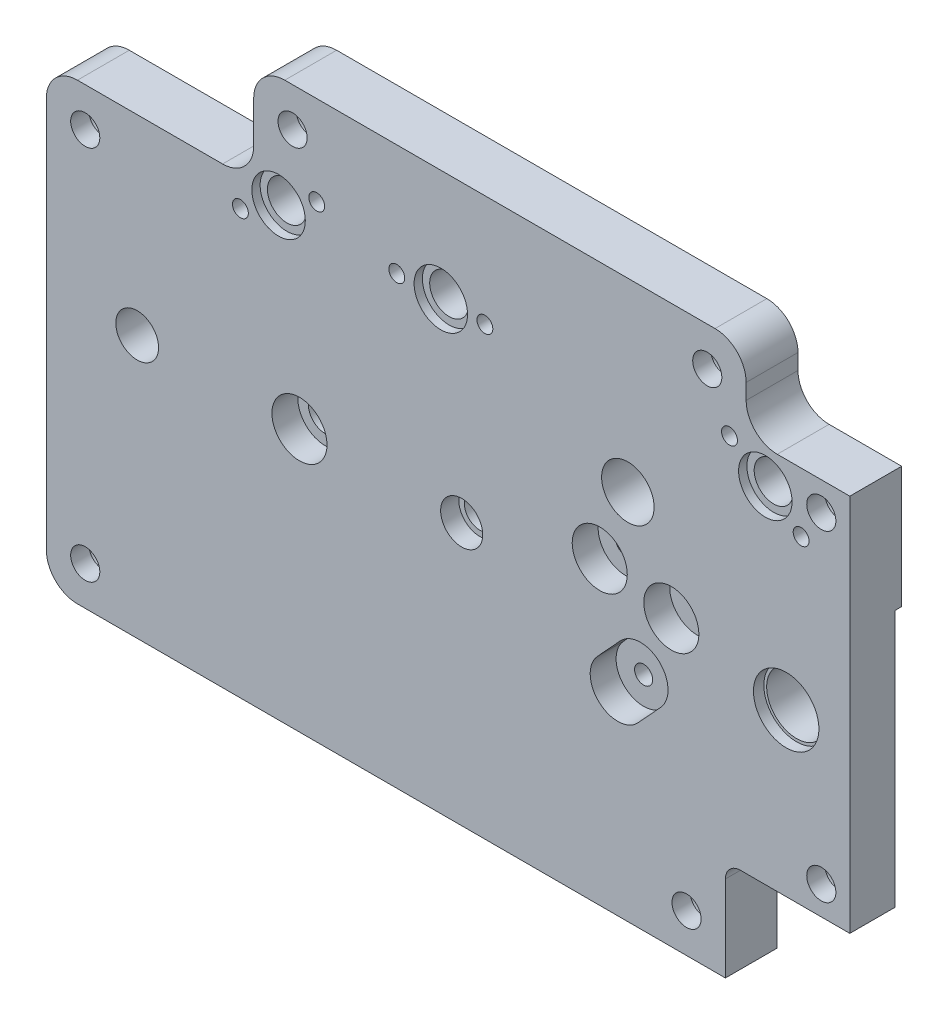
SolidWorks part; units mm, degrees
ref_plane "Front" through (0, 0, 0) normal (0, 0, 1) x (1, 0, 0)
ref_plane "Top" through (0, 0, 0) normal (0, 1, 0) x (1, 0, 0)
ref_plane "Right" through (0, 0, 0) normal (1, 0, 0) x (0, 0, -1)
ref_plane "Plane1"
sketch "Sketch1" plane through (0, 0, 3.2) normal (0, 0, -1) x (-1, 0, 0)
  line L0 (745.49, 149.225) -> (745.49, -180.975) construction
  line L1 (778.51, 41.275) -> (883.92, 41.275)
  line L2 (745.49, 22.225) -> (745.49, -95.25)
  line L3 (745.49, -95.25) -> (934.72, -95.25)
  line L4 (942.34, 8.255) -> (942.34, -87.63)
  line L5 (777.367, 0) -> (817.118, 0) construction
  line L6 (745.49, 22.225) -> (763.27, 22.225)
  line L7 (770.89, 29.845) -> (770.89, 33.655)
  line L8 (891.54, 33.655) -> (891.54, 23.495)
  line L9 (899.16, 15.875) -> (934.72, 15.875)
  arc A0 (770.89, 33.655) -> (778.51, 41.275) centre (778.51, 33.655) cw
  arc A1 (807.4481, 26.2197) -> (796.6984, 26.9766) centre (801.6947, 21.2233) ccw construction
  arc A2 (794.0493, -74.565) -> (813.757, -75.9528) centre (804.5971, -65.405) ccw construction
  arc A5 (934.72, -95.25) -> (942.34, -87.63) centre (934.72, -87.63) ccw
  arc A8 (763.27, 22.225) -> (770.89, 29.845) centre (763.27, 29.845) ccw
  arc A9 (934.72, 15.875) -> (942.34, 8.255) centre (934.72, 8.255) cw
  arc A10 (891.54, 33.655) -> (883.92, 41.275) centre (883.92, 33.655) ccw
  arc A11 (891.54, 23.495) -> (899.16, 15.875) centre (899.16, 23.495) ccw
  point P16 (770.89, 41.275)
  point P25 (745.49, 22.225)
  point P28 (770.89, 22.225)
  point P29 (942.34, 15.875)
  point P34 (891.54, 15.875)
extrude "Boss-Extrude1" add sketch "Sketch1" against normal blind 12.7 flip side to cut
ref_plane "Insert Form Offset Depth" through (0, 0, 4.7999) normal (0, 0, -1) x (-1, 0, 0)
sketch "Sketch2" plane through (0, 0, 4.7999) normal (0, 0, -1) x (-1, 0, 0)
  line L4 (1196.34, -7.5678) -> (745.49, -7.5678)
  line L5 (745.49, -7.5678) -> (745.49, -75.7668)
  line L6 (745.49, -75.7668) -> (1196.34, -75.7668)
  line L7 (1196.34, -75.7668) -> (1196.34, -7.5678)
  line L8 (1196.34, -7.5678) -> (745.49, -7.5678)
  line L9 (745.49, -7.5678) -> (745.49, -75.7668)
  line L10 (745.49, -75.7668) -> (1196.34, -75.7668)
  line L11 (1196.34, -75.7668) -> (1196.34, -7.5678)
  dimension "D1" = 0
extrude "Cut-Extrude1" cut sketch "Sketch2" along normal through all
hole_wizard "Hole1" positions "Point_Sketch" profile "Profil_Sketch" legacy
sketch "Point_Sketch" plane through (-764.7331, -20.3493, 15.9) normal (0, 0, -1) x (1, 0, 0)
  point P0 (3.6543, 10.6011)
sketch "Profil_Sketch" plane through (-761.0788, -30.9504, 15.9) normal (1, 0, 0) x (0, -1, 0)
  line L0 (0, 0) -> (0, 12.7) construction
  line L1 (0, 12.7) -> (7.3228, 12.7)
  line L2 (7.3228, 12.7) -> (7.3228, 2.54)
  line L3 (7.3228, 2.54) -> (8.0175, 2.54)
  line L4 (8.0175, 0) -> (0, 0) construction
  line L5 (0, 12.7) -> (0, -1)
  line L6 (-7.3228, 2.54) -> (-8.0175, 2.54) construction
  line L7 (0, -4.2442) -> (0, 117.3081) construction
  line L8 (0, -1) -> (8.0175, -1)
  line L9 (8.0175, -1) -> (8.0175, 2.54)
  dimension "Diameter" = 14.6456
  dimension "Depth" = 12.7
  dimension "L1" = 2.54
  dimension "A1" = 180
  dimension "FixDim" = 1
other "usin_DS100_IMPAX VARIABLE INCH ISPV 062-300 4 RD P=0.5250<1>"
hole_wizard "Hole11" positions "Point_Sketch1" profile "Profil_Sketch1" legacy
sketch "Point_Sketch1" plane through (-806.009, -36.6401, 15.9) normal (0, 0, -1) x (1, 0, 0)
  point P0 (3.6543, 10.6011)
  point P2 (9.231, 4.5369)
sketch "Profil_Sketch1" plane through (-802.3548, -47.2413, 15.9) normal (1, 0, 0) x (0, -1, 0)
  line L0 (0, 0) -> (0, 12.7) construction
  line L1 (0, 12.7) -> (2.2187, 12.7)
  line L2 (2.2187, 12.7) -> (2.2187, 5.7893)
  line L3 (2.2187, 5.7893) -> (6.7469, 3.175)
  line L4 (6.7469, 0) -> (0, 0) construction
  line L5 (0, 12.7) -> (0, -1)
  line L6 (-2.2187, 5.7893) -> (-6.7469, 3.175) construction
  line L7 (0, -4.2442) -> (0, 117.3081) construction
  line L8 (0, -1) -> (6.7469, -1)
  line L9 (6.7469, -1) -> (6.7469, 3.175)
  dimension "Diameter" = 4.4374
  dimension "Depth" = 12.7
  dimension "L1" = 3.175
  dimension "A1" = 120
  dimension "FixDim" = 1
other "usin_DS100<2>"
hole_wizard "Hole12" positions "Point_Sketch2" profile "Profil_Sketch2" legacy
sketch "Point_Sketch2" plane through (-792.875, -14.9521, 15.9) normal (0, 0, -1) x (1, 0, 0)
  point P0 (3.6543, 10.6011)
sketch "Profil_Sketch2" plane through (-789.2208, -25.5532, 15.9) normal (1, 0, 0) x (0, -1, 0)
  line L0 (0, 0) -> (0, 12.7) construction
  line L1 (0, 12.7) -> (1.6677, 12.7)
  line L2 (1.6677, 12.7) -> (1.6677, 6.35)
  line L3 (1.6677, 6.35) -> (6.7469, 6.35)
  line L4 (6.7469, 0) -> (0, 0) construction
  line L5 (0, 12.7) -> (0, -1)
  line L6 (-1.6677, 6.35) -> (-6.7469, 6.35) construction
  line L7 (0, -4.2442) -> (0, 117.3081) construction
  line L8 (0, -1) -> (6.7469, -1)
  line L9 (6.7469, -1) -> (6.7469, 6.35)
  dimension "Diameter" = 3.3354
  dimension "Depth" = 12.7
  dimension "L1" = 6.35
  dimension "A1" = 180
  dimension "FixDim" = 1
other "usin_DS100<3>"
hole_wizard "Hole13" positions "Point_Sketch3" profile "Profil_Sketch3" legacy
sketch "Point_Sketch3" plane through (-810.4146, -11.0849, 15.9) normal (0, 0, -1) x (1, 0, 0)
  point P0 (3.6543, 10.6011)
sketch "Profil_Sketch3" plane through (-806.7604, -21.6861, 15.9) normal (1, 0, 0) x (0, -1, 0)
  line L0 (0, 0) -> (0, 12.7) construction
  line L1 (0, 12.7) -> (2.5184, 12.7)
  line L2 (2.5184, 12.7) -> (2.5184, 6.35)
  line L3 (2.5184, 6.35) -> (6.7469, 6.35)
  line L4 (6.7469, 0) -> (0, 0) construction
  line L5 (0, 12.7) -> (0, -1)
  line L6 (-2.5184, 6.35) -> (-6.7469, 6.35) construction
  line L7 (0, -4.2442) -> (0, 117.3081) construction
  line L8 (0, -1) -> (6.7469, -1)
  line L9 (6.7469, -1) -> (6.7469, 6.35)
  dimension "Diameter" = 5.0368
  dimension "Depth" = 12.7
  dimension "L1" = 6.35
  dimension "A1" = 180
  dimension "FixDim" = 1
other "usin_DS100<4>"
hole_wizard "Hole14" positions "Point_Sketch4" profile "Profil_Sketch4" hole size "#97" standard "ANSI Inch"
sketch "Point_Sketch4" plane through (-803.5274, 6.4914, 15.9) normal (0, 0, -1) x (1, 0, 0)
  point P0 (3.6543, 10.6011)
sketch "Profil_Sketch4" plane through (-799.8731, -4.1097, 15.9) normal (1, 0, 0) x (0, -1, 0)
  line L0 (0, 0) -> (0, 10.414)
  line L1 (0, 10.414) -> (6.43, 10.414)
  line L2 (6.43, 10.414) -> (6.43, 0)
  line L5 (6.43, 0) -> (0, 0)
  line L10 (0, 10.414) -> (-6.43, 10.414) construction
  line L11 (0, -6.35) -> (0, 107.95) construction
  dimension "Hole Dia." = 12.86
  dimension "Hole Depth" = 10.414
  dimension "A1" = 180
other "usin_DS100_o_DAYTON VERSATILE INCH VPO-50-2130-P0.1999-W0.1310 X2-0<1>"
ref_plane "Plane2"
sketch "Sketch11" plane through (0, 0, 5.6127) normal (0, 0, 1) x (1, 0, 0)
  line L2 (-798.7299, -5.6899) -> (-797.9229, -4.137)
  line L3 (-801.0164, -2.5295) -> (-801.8234, -4.0824)
  line L4 (-798.7299, -5.6899) -> (-797.9229, -4.137)
  line L5 (-801.0164, -2.5295) -> (-801.8234, -4.0824)
  arc A2 (-801.8234, -4.0824) -> (-798.7299, -5.6899) centre (-800.2766, -4.8861) ccw
  arc A3 (-797.9229, -4.137) -> (-801.0164, -2.5295) centre (-799.4697, -3.3333) ccw
  arc A4 (-801.8234, -4.0824) -> (-798.7299, -5.6899) centre (-800.2766, -4.8861) ccw
  arc A5 (-797.9229, -4.137) -> (-801.0164, -2.5295) centre (-799.4697, -3.3333) ccw
extrude "Cut-Extrude2" cut sketch "Sketch11" against normal through all and the other way through all draft 1
hole_wizard "Hole16" positions "Point_Sketch5" profile "Profil_Sketch5" legacy
sketch "Point_Sketch5" plane through (-883.9861, -20.3493, 15.9) normal (0, 0, -1) x (1, 0, 0)
  point P0 (3.6543, 10.6011)
sketch "Profil_Sketch5" plane through (-880.3318, -30.9504, 15.9) normal (1, 0, 0) x (0, -1, 0)
  line L0 (0, 0) -> (0, 12.7) construction
  line L1 (0, 12.7) -> (4.1834, 12.7)
  line L2 (4.1834, 12.7) -> (4.1834, 6.35)
  line L3 (4.1834, 6.35) -> (6.7469, 6.35)
  line L4 (6.7469, 0) -> (0, 0) construction
  line L5 (0, 12.7) -> (0, -1)
  line L6 (-4.1834, 6.35) -> (-6.7469, 6.35) construction
  line L7 (0, -4.2442) -> (0, 117.3081) construction
  line L8 (0, -1) -> (6.7469, -1)
  line L9 (6.7469, -1) -> (6.7469, 6.35)
  dimension "Diameter" = 8.3668
  dimension "Depth" = 12.7
  dimension "L1" = 6.35
  dimension "A1" = 180
  dimension "FixDim" = 1
other "usin_DS100<5>"
hole_wizard "Hole17" positions "Point_Sketch6" profile "Profil_Sketch6" legacy
sketch "Point_Sketch6" plane through (-844.2351, -20.3493, 15.9) normal (0, 0, -1) x (1, 0, 0)
  point P0 (3.6543, 10.6011)
sketch "Profil_Sketch6" plane through (-840.5808, -30.9504, 15.9) normal (1, 0, 0) x (0, -1, 0)
  line L0 (0, 0) -> (0, 12.7) construction
  line L1 (0, 12.7) -> (3.8024, 12.7)
  line L2 (3.8024, 12.7) -> (3.8024, 4.445)
  line L3 (3.8024, 4.445) -> (5.1594, 4.445)
  line L4 (5.1594, 0) -> (0, 0) construction
  line L5 (0, 12.7) -> (0, -1)
  line L6 (-3.8024, 4.445) -> (-5.1594, 4.445) construction
  line L7 (0, -4.2442) -> (0, 117.3081) construction
  line L8 (0, -1) -> (5.1594, -1)
  line L9 (5.1594, -1) -> (5.1594, 4.445)
  dimension "Diameter" = 7.6048
  dimension "Depth" = 12.7
  dimension "L1" = 4.445
  dimension "A1" = 180
  dimension "FixDim" = 1
other "usin_DS100<6>"
hole_wizard "Hole18" positions "Point_Sketch7" profile "Profil_Sketch7" counterbore size "1/4" standard "ANSI Inch"
sketch "Point_Sketch7" plane through (-779.0601, 14.905, 15.9) normal (0, 0, -1) x (1, 0, 0)
  point P0 (12.8691, 0.935)
  point P2 (-66.6329, 0.935)
  point P4 (-106.3839, 0.935)
sketch "Profil_Sketch7" plane through (-766.191, 13.97, 15.9) normal (1, 0, 0) x (0, -1, 0)
  line L0 (0, 0) -> (0, 12.7)
  line L1 (0, 12.7) -> (4.7625, 12.7)
  line L3 (4.7625, 12.7) -> (4.7625, 2.032)
  line L4 (4.7625, 2.032) -> (6.5481, 2.032)
  line L5 (6.5481, 2.032) -> (6.5481, 0)
  line L7 (6.5481, 0) -> (0, 0)
  line L11 (0, -6.35) -> (0, 107.95) construction
  dimension "Diameter" = 9.525
  dimension "Thru Hole Depth" = 12.7
  dimension "L1" = 2.032
other "usin_LS160<1>"
hole_wizard "Hole19" positions "Point_Sketch8" profile "Profil_Sketch8" hole size "Ø0.15" standard "ISO"
sketch "Point_Sketch8" plane through (-916.4285, -20.3493, 4.7999) normal (0, 0, 1) x (-1, 0, 0)
  point P0 (3.6543, 10.6011)
sketch "Profil_Sketch8" plane through (-920.0828, -30.9504, 4.7999) normal (1, 0, 0) x (0, 1, 0)
  line L0 (0, 0) -> (0, 11.1001)
  line L1 (0, 11.1001) -> (5.24, 11.1001)
  line L2 (5.24, 11.1001) -> (5.24, 0)
  line L5 (5.24, 0) -> (0, 0)
  line L11 (0, -6.35) -> (0, 107.95) construction
  dimension "Diameter" = 10.48
  dimension "Thru Hole Depth" = 11.1001
other "usin_DL090<1>"
sketch "Sketch12" plane through (0, 0, 15.9) normal (0, 0, 1) x (1, 0, 0)
  line L4 (-1148.715, -74.2315) -> (-1148.715, -101.7905)
  line L5 (-968.248, -70.5485) -> (-1145.032, -70.5485)
  line L6 (-964.565, -101.7905) -> (-964.565, -74.2315)
  line L7 (-1145.032, -105.4735) -> (-968.248, -105.4735)
  line L8 (-1148.715, -74.2315) -> (-1148.715, -101.7905)
  line L9 (-968.248, -70.5485) -> (-1145.032, -70.5485)
  line L10 (-964.565, -101.7905) -> (-964.565, -74.2315)
  line L11 (-1145.032, -105.4735) -> (-968.248, -105.4735)
  line L12 (-775.97, -74.2315) -> (-775.97, -101.7905)
  line L13 (-714.3299, -70.5485) -> (-772.287, -70.5485)
  line L14 (-706.12, -105.4735) -> (-706.12, -78.7584)
  line L15 (-772.287, -105.4735) -> (-706.12, -105.4735)
  line L16 (-775.97, -74.2315) -> (-775.97, -101.7905)
  line L17 (-714.3299, -70.5485) -> (-772.287, -70.5485)
  line L18 (-706.12, -105.4735) -> (-706.12, -78.7584)
  line L19 (-772.287, -105.4735) -> (-706.12, -105.4735)
  line L38 (-706.12, -78.7584) -> (-714.3299, -70.5485)
  line L39 (-706.12, -78.7584) -> (-714.3299, -70.5485)
  arc A2 (-772.287, -70.5485) -> (-775.97, -74.2315) centre (-772.287, -74.2315) ccw
  arc A3 (-775.97, -101.7905) -> (-772.287, -105.4735) centre (-772.287, -101.7905) ccw
  arc A4 (-1145.032, -70.5485) -> (-1148.715, -74.2315) centre (-1145.032, -74.2315) ccw
  arc A5 (-964.565, -74.2315) -> (-968.248, -70.5485) centre (-968.248, -74.2315) ccw
  arc A6 (-968.248, -105.4735) -> (-964.565, -101.7905) centre (-968.248, -101.7905) ccw
  arc A7 (-1148.715, -101.7905) -> (-1145.032, -105.4735) centre (-1145.032, -101.7905) ccw
  arc A8 (-1145.032, -70.5485) -> (-1148.715, -74.2315) centre (-1145.032, -74.2315) ccw
  arc A9 (-964.565, -74.2315) -> (-968.248, -70.5485) centre (-968.248, -74.2315) ccw
  arc A10 (-968.248, -105.4735) -> (-964.565, -101.7905) centre (-968.248, -101.7905) ccw
  arc A11 (-1148.715, -101.7905) -> (-1145.032, -105.4735) centre (-1145.032, -101.7905) ccw
  arc A12 (-772.287, -70.5485) -> (-775.97, -74.2315) centre (-772.287, -74.2315) ccw
  arc A13 (-775.97, -101.7905) -> (-772.287, -105.4735) centre (-772.287, -101.7905) ccw
  dimension "D1" = 0
  dimension "D2" = 0
extrude "Cut-Extrude3" cut sketch "Sketch12" against normal through all
hole_wizard "Hole110" positions "Point_Sketch9" profile "Profil_Sketch9" counterbore size "1/4" standard "ANSI Inch"
sketch "Point_Sketch9" plane through (-919.9459, 7.285, 3.2) normal (0, 0, 1) x (-1, 0, 0)
  point P0 (12.8691, 0.935)
  point P2 (-37.9309, -24.465)
  point P4 (-139.5309, -24.465)
  point P6 (-134.4509, 93.01)
  point P8 (12.8691, 93.01)
  point P10 (-167.4709, -7.955)
  point P12 (-167.4709, 70.8485)
sketch "Profil_Sketch9" plane through (-932.815, 6.35, 3.2) normal (1, 0, 0) x (0, 1, 0)
  line L0 (0, 0) -> (0, 12.7)
  line L1 (0, 12.7) -> (3.5687, 12.7)
  line L3 (3.5687, 12.7) -> (3.5687, 8.255)
  line L4 (3.5687, 8.255) -> (5.3594, 8.255)
  line L5 (5.3594, 8.255) -> (5.3594, 0)
  line L7 (5.3594, 0) -> (0, 0)
  line L11 (0, -6.35) -> (0, 107.95) construction
  dimension "Diameter" = 7.1374
  dimension "Thru Hole Depth" = 12.7
  dimension "L1" = 8.255
other "usin_LS160_.25-20x.625-SHCS<2>"
hole_wizard "Hole112" positions "Point_Sketch10" profile "Profil_Sketch10" legacy
sketch "Point_Sketch10" plane through (-778.6179, 30.8619, 15.9) normal (0, 0, -1) x (1, 0, 0)
  point P0 (3.6543, 10.6011)
  point P2 (-116.1749, 22.2894)
  point P4 (21.1995, 23.1826)
  point P6 (-56.2801, 16.8919)
  point P8 (-97.4774, 11.4944)
  point P10 (-77.8701, 16.8919)
sketch "Profil_Sketch10" plane through (-774.9636, 20.2607, 15.9) normal (1, 0, 0) x (0, -1, 0)
  line L0 (0, 0) -> (0, 12.7) construction
  line L1 (0, 12.7) -> (0.7937, 12.7)
  line L2 (0.7937, 12.7) -> (0.7938, 5.7436)
  line L3 (0.7938, 5.7436) -> (1.9431, 5.08)
  line L4 (1.9431, 0) -> (0, 0) construction
  line L5 (0, 12.7) -> (0, -1)
  line L6 (-0.7938, 5.7436) -> (-1.9431, 5.08) construction
  line L7 (0, -4.2442) -> (0, 117.3081) construction
  line L8 (0, -1) -> (1.9431, -1)
  line L9 (1.9431, -1) -> (1.9431, 5.08)
  dimension "Diameter" = 1.5875
  dimension "Depth" = 12.7
  dimension "L1" = 5.08
  dimension "A1" = 120
  dimension "FixDim" = 1
other "usin_DS100<7>"
sketch "Sketch13" plane through (0, 0, 15.9) normal (0, 0, 1) x (1, 0, 0)
  line L0 (-807.321, -42.6743) -> (-801.7442, -36.61)
  line L1 (-797.3886, -51.8082) -> (-791.8118, -45.744)
  arc A0 (-803.4995, -40.5922) -> (-795.6333, -47.826) centre (-802.3548, -47.2413) ccw construction
  arc A1 (-795.6333, -47.826) -> (-803.4995, -40.5922) centre (-796.778, -41.177) ccw construction
  arc A2 (-807.321, -42.6743) -> (-797.3886, -51.8082) centre (-802.3548, -47.2413) ccw
  arc A3 (-791.8118, -45.744) -> (-801.7442, -36.61) centre (-796.778, -41.177) ccw
extrude "Cut-Extrude4" cut sketch "Sketch13" against normal blind 6.35
